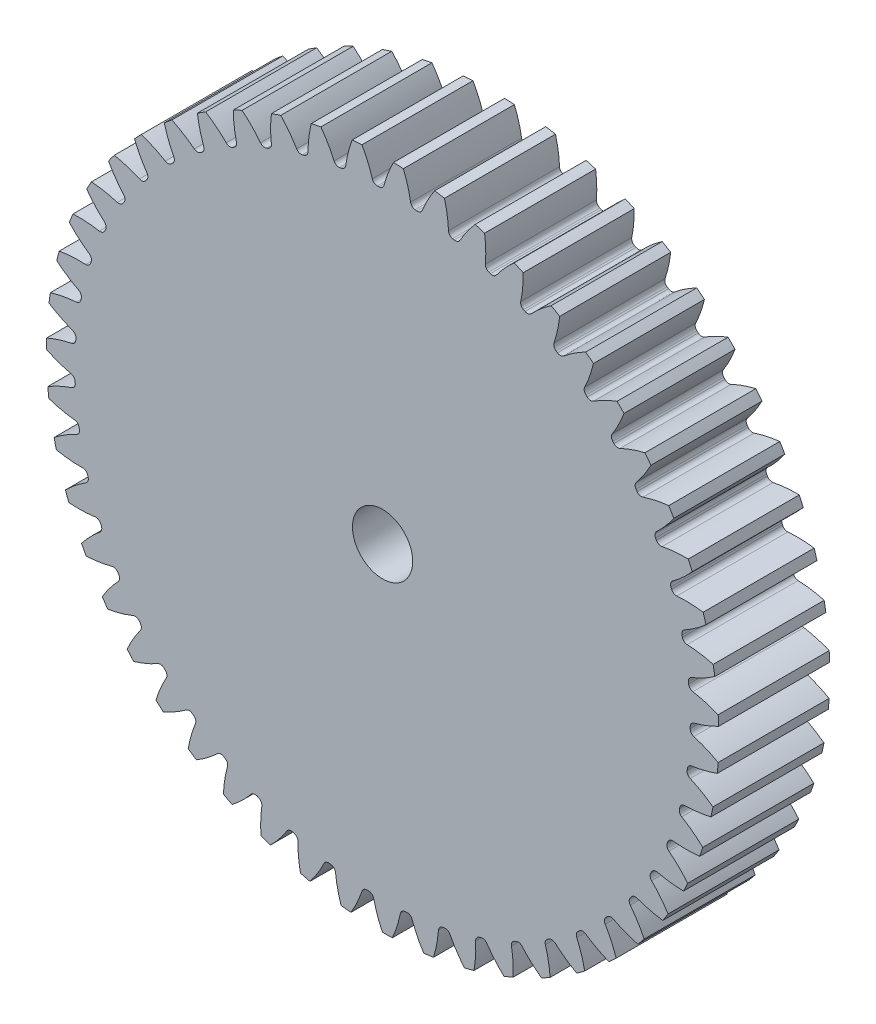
SolidWorks part; units mm, degrees
ref_plane "Front" through (0, 0, 0) normal (0, 0, 1) x (1, 0, 0)
ref_plane "Top" through (0, 0, 0) normal (0, 1, 0) x (1, 0, 0)
ref_plane "Right" through (0, 0, 0) normal (1, 0, 0) x (0, 0, -1)
sketch "Sketch3" plane through (0, 0, 0) normal (0, 0, 1) x (1, 0, 0)
  circle A0 centre (0, 0) radius 269.24
  dimension "od" = 538.48
extrude "gearBody" add sketch "Sketch3" along normal blind 88.9
sketch "Sketch2" plane through (0, 0, 0) normal (0, 0, 1) x (1, 0, 0)
  line L0 (0, 0) -> (224.9236, 93.1664) construction
  line L1 (268.8213, -17.1317) -> (0, 0) construction
  line L2 (0, 0) -> (36.3143, 0) construction
  line L3 (259.0539, 3.6773) -> (258.7918, -12.2165) construction
  line L5 (258.9229, -4.2696) -> (0, 0) construction
  line L7 (0, 0) -> (243.4556, 0) construction
  arc A0 (243.4542, -0.8006) -> (243.3483, -7.2267) centre (0, 0) ccw construction
  arc A1 (269.1153, 8.1942) -> (268.6988, -17.0627) centre (0, 0) ccw construction
  arc A2 (259.0539, 3.6773) -> (258.7918, -12.2165) centre (0, 0) ccw construction
  arc A3 (246.334, -4.7623) -> (246.3571, -3.3621) centre (0, 0) ccw
  arc A4 (268.8213, -17.1317) -> (249.2789, -8.8026) centre (221.7296, -100.5317) ccw
  arc A5 (268.8213, -17.1317) -> (269.24, 8.2592) centre (0, 0) ccw
  arc A6 (269.24, 8.2592) -> (249.4336, 0.5789) centre (224.9236, 93.1664) cw
  arc A7 (246.3571, -3.3621) -> (249.4336, 0.5789) centre (250.4918, -3.4185) cw
  arc A8 (249.2789, -8.8026) -> (246.334, -4.7623) centre (250.4683, -4.8423) cw
  point P6 (269.24, 8.2592)
  point P22 (268.8213, -17.1317)
  dimension "baseDia" = 486.9111
  dimension "od" = 538.48
  dimension "pd" = 518.16
  dimension "rd" = 492.76
  dimension "rFillet" = 4.1351
  dimension "pointX" = 269.24
  dimension "pointY" = 8.2592
  dimension "CTT" = 15.8937
  dimension "flankCenterAngle" = 22.5
extrude "toothCut" cut sketch "Sketch2" along normal through all
pattern_circular "CirPattern1" count 51 over 360 about axis through (0, 0, 0) along (0, 0, 1) of "toothCut"
sketch "hub1Dia" plane through (0, 0, 0) normal (0, 0, -1) x (-1, 0, 0)
  circle A0 centre (0, 0) radius 12.7
  dimension "hub1Dia" = 25.4
sketch "hub2Dia" plane through (0, 0, 88.9) normal (0, 0, 1) x (1, 0, 0)
  circle A0 centre (0, 0) radius 12.7
  dimension "hub2dia" = 25.4
sketch "boreDia" plane through (0, 0, 0) normal (0, 0, 1) x (1, 0, 0)
  circle A0 centre (0, 0) radius 24.13
  dimension "boreDia" = 48.26
extrude "bore" cut sketch "boreDia" against normal mid plane 25400
